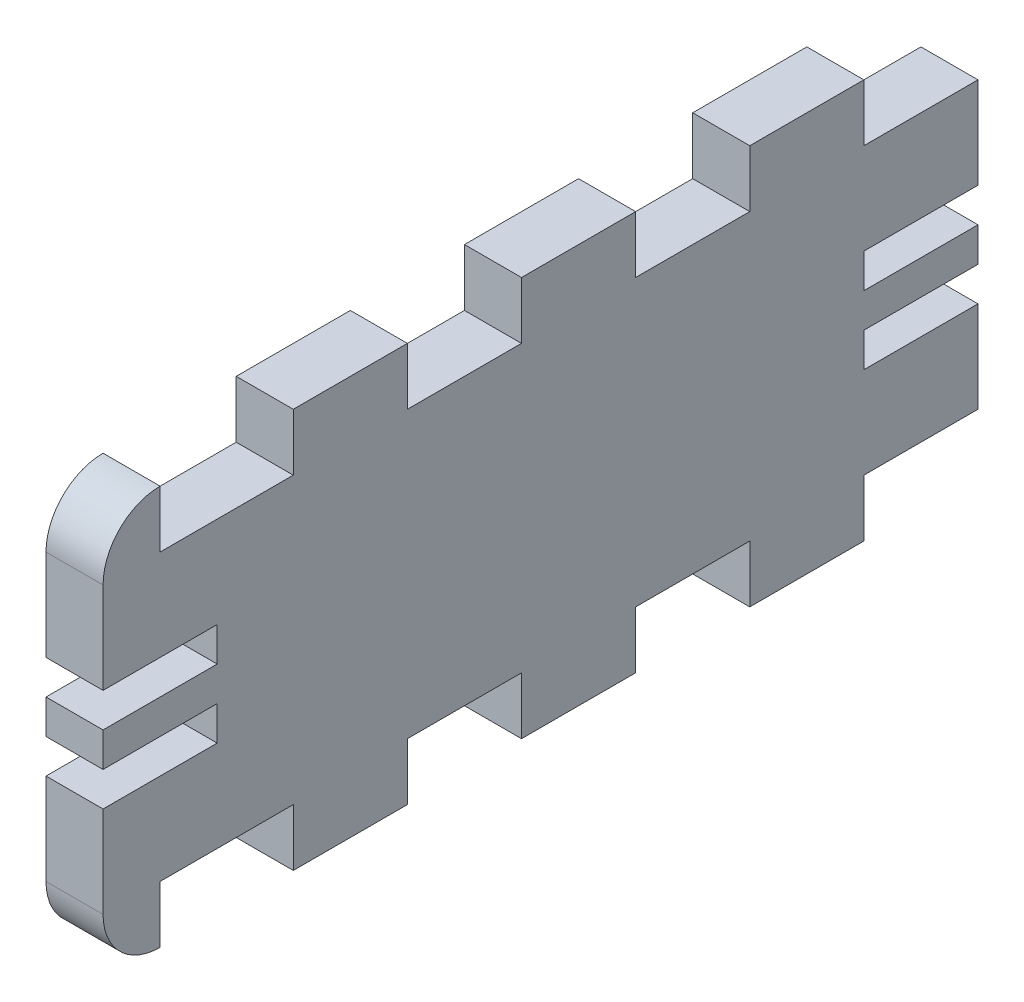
SolidWorks part; units mm, degrees
ref_plane "Front Plane" through (0, 0, 0) normal (0, 0, 1) x (1, 0, 0)
ref_plane "Top Plane" through (0, 0, 0) normal (0, 1, 0) x (1, 0, 0)
ref_plane "Right Plane" through (0, 0, 0) normal (1, 0, 0) x (0, 0, -1)
sketch "Sketch1" plane through (0, 0, 0) normal (1, 0, 0) x (0, 0, -1)
  line L1 (-23, -10.5) -> (23, -10.5)
  line L2 (-23, -10.5) -> (-23, 10.5)
  line L3 (-23, 10.5) -> (23, 10.5)
  line L4 (23, -10.5) -> (23, 10.5)
  line L5 (-23, -10.5) -> (23, 10.5) construction
  line L6 (-23, 10.5) -> (23, -10.5) construction
  point P0 (0, 0)
  dimension "D1" = 21
  dimension "D2" = 46
extrude "Boss-Extrude1" add sketch "Sketch1" along normal blind 3
fillet "Fillet1" radius 3 2 edges at (1.5, -10.5, 23) (1.5, 10.5, 23)
sketch "Sketch2" plane through (0, 0, 0) normal (-1, 0, 0) x (0, 0, 1)
  line L0 (23, 7.5) -> (23, -7.5) construction
  line L1 (17, 2.7) -> (23, 2.7)
  line L2 (17, 2.7) -> (17, 0.9)
  line L3 (17, 0.9) -> (23, 0.9)
  line L4 (23, 2.7) -> (23, 0.9)
  line L5 (-23, -2.7) -> (-23, -0.9)
  line L6 (17, -0.9) -> (23, -0.9)
  line L7 (17, -0.9) -> (17, -2.7)
  line L8 (17, -2.7) -> (23, -2.7)
  line L9 (23, -0.9) -> (23, -2.7)
  line L10 (-17, -0.9) -> (-23, -0.9)
  line L11 (-17, -0.9) -> (-17, -2.7)
  line L12 (-17, -2.7) -> (-23, -2.7)
  line L13 (-23, 0.9) -> (-23, 2.7)
  line L14 (-17, 0.9) -> (-23, 0.9)
  line L15 (-17, 0.9) -> (-17, 2.7)
  line L16 (-17, 2.7) -> (-23, 2.7)
  line L18 (-23, -10.5) -> (-23, 10.5) construction
  dimension "D1" = 6
  dimension "D2" = 6
extrude "Cut-Extrude1" cut sketch "Sketch2" against normal blind 10
sketch "Sketch3" plane through (3, 0, 0) normal (1, 0, 0) x (0, 0, -1)
  line L0 (23, 10.5) -> (-20, 10.5) construction
  line L1 (-20, 7.5) -> (-13, 7.5)
  line L2 (-20, 7.5) -> (-20, 10.5)
  line L3 (-20, 10.5) -> (-13, 10.5)
  line L4 (-13, 7.5) -> (-13, 10.5)
  line L5 (23, -10.5) -> (23, -2.7) construction
  line L6 (-7, 7.5) -> (-1, 7.5)
  line L7 (-7, 7.5) -> (-7, 10.5)
  line L8 (-7, 10.5) -> (-1, 10.5)
  line L9 (-1, 7.5) -> (-1, 10.5)
  line L10 (5, 7.5) -> (11, 7.5)
  line L11 (5, 7.5) -> (5, 10.5)
  line L12 (5, 10.5) -> (11, 10.5)
  line L13 (11, 7.5) -> (11, 10.5)
  line L14 (17, 7.5) -> (23, 7.5)
  line L15 (17, 7.5) -> (17, 10.5)
  line L16 (17, 10.5) -> (23, 10.5)
  line L17 (23, 7.5) -> (23, 10.5)
  line L18 (-20, -10.5) -> (23, -10.5) construction
  line L19 (17, -7.5) -> (23, -7.5)
  line L20 (17, -7.5) -> (17, -10.5)
  line L21 (17, -10.5) -> (23, -10.5)
  line L22 (23, -7.5) -> (23, -10.5)
  line L23 (11, -7.5) -> (5, -7.5)
  line L24 (11, -7.5) -> (11, -10.5)
  line L25 (11, -10.5) -> (5, -10.5)
  line L26 (5, -7.5) -> (5, -10.5)
  line L28 (-1, -7.5) -> (-7, -7.5)
  line L29 (-1, -7.5) -> (-1, -10.5)
  line L30 (-1, -10.5) -> (-7, -10.5)
  line L31 (-7, -7.5) -> (-7, -10.5)
  line L32 (-13, -7.5) -> (-20, -7.5)
  line L33 (-13, -7.5) -> (-13, -10.5)
  line L34 (-13, -10.5) -> (-20, -10.5)
  line L35 (-20, -7.5) -> (-20, -10.5)
extrude "Cut-Extrude2" cut sketch "Sketch3" against normal blind 10
